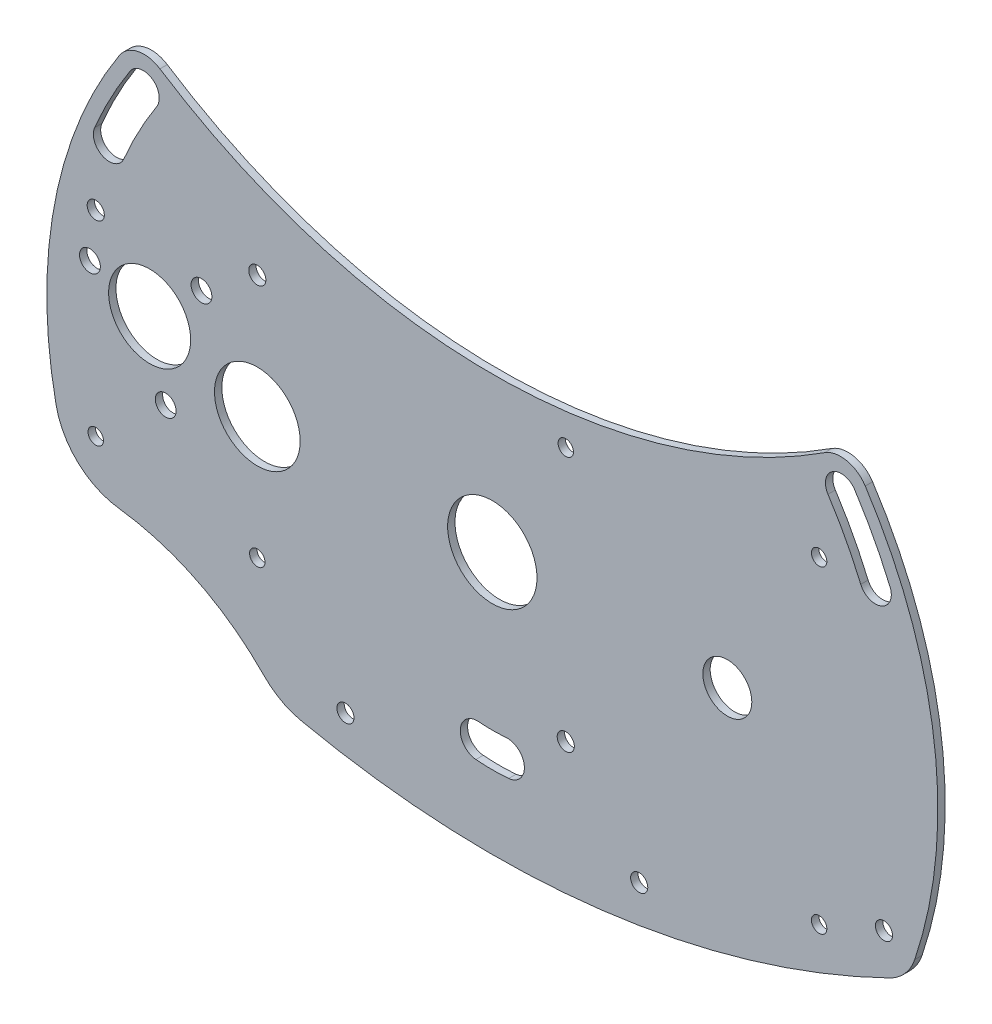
SolidWorks part; units mm, degrees
ref_plane "Face" through (0, 0, 0) normal (0, 0, 1) x (1, 0, 0)
ref_plane "Dessus" through (0, 0, 0) normal (0, 1, 0) x (1, 0, 0)
ref_plane "Droite" through (0, 0, 0) normal (1, 0, 0) x (0, 0, -1)
sketch "Esquisse1" plane through (0, 0, 0) normal (0, 0, 1) x (1, 0, 0)
  line L0 (0, 393.4751) -> (0, -393.4751) construction
  line L1 (393.4751, 0) -> (-393.4751, 0) construction
  line L2 (-150.6429, -313) -> (150.6429, -313) construction
  line L3 (-96, -313) -> (-222.1428, -274.4343) construction
  line L4 (-133.4329, -327.6979) -> (-118.8143, -279.8827) construction
  line L6 (31.9096, -50) -> (-31.9096, -50) construction
  line L9 (0, -313) -> (179.235, -344.604) construction
  arc A0 (135.7812, -209.913) -> (-135.7812, -209.913) centre (0, 0) cw
  arc A1 (-78.1861, -411.6448) -> (162.3743, -382.4674) centre (0, -50) ccw
  circle A2 centre (0, -313) radius 18.25
  circle A3 centre (96, -313) radius 10
  circle A4 centre (-96, -313) radius 17.5
  circle A5 centre (-139.99, -299.5509) radius 16.75
  circle A6 centre (-164.3758, -292.0954) radius 4.25
  circle A7 centre (-118.8143, -279.8827) radius 4.25
  circle A8 centre (-133.4329, -327.6979) radius 4.25
  arc A9 (-152.3433, -213.4233) -> (-178.1714, -350.134) centre (0, -313) ccw
  arc A10 (152.3433, -213.4233) -> (172.56, -370.8538) centre (0, -313) cw
  arc A11 (-135.7812, -209.913) -> (-152.3433, -213.4233) centre (-142.2987, -219.9888) ccw
  arc A12 (152.3433, -213.4233) -> (135.7812, -209.913) centre (142.2987, -219.9888) ccw
  arc A13 (162.3743, -382.4674) -> (172.56, -370.8538) centre (153.5973, -364.4962) ccw
  arc A14 (-93.3436, -403.2479) -> (-152.5404, -373.7792) centre (-165, -473) ccw
  arc A15 (-152.5404, -373.7792) -> (-178.1714, -350.134) centre (-148.8025, -344.013) cw
  arc A16 (-78.1861, -411.6448) -> (-93.3436, -403.2479) centre (-71.8467, -382.3222) cw
  point P28 (145.3191, -203.4265)
  point P43 (0, -50)
  dimension "D4" = 36.5
  dimension "D5" = 20
  dimension "D6" = 96
  dimension "D8" = 33.5
  dimension "D9" = 25.5
  dimension "D10" = 40
  dimension "D11" = 8.5
  dimension "D12" = 50
  dimension "D13" = 182
  dimension "D15" = 182
  dimension "D18" = 12
  dimension "D19" = 12
  dimension "D20" = 30
  dimension "D22" = 250
  dimension "D23" = 370
  dimension "D17" = 100
  dimension "D24" = 165
  dimension "D25" = 35
  dimension "D26" = 96
  dimension "D27" = 46
  dimension "D28" = 160
  dimension "D34" = 10
  dimension "D16" = 20
  dimension "D3" = 313
  dimension "D7" = 17
  dimension "D14" = 31.5
  dimension "D21" = 263
extrude "support" add sketch "Esquisse1" along normal blind 3
sketch "Esquisse2" plane through (0, 0, 3) normal (0, 0, 1) x (1, 0, 0)
  line L0 (154.5138, -313) -> (-170.0077, -313) construction
  line L1 (0, -205.5414) -> (0, -432.4915) construction
  line L2 (96, -313) -> (133.5, -248.0481) construction
  circle A0 centre (0, -313) radius 18.25 construction
  circle A1 centre (30, -261) radius 3.15
  circle A2 centre (30, -365) radius 3.5
  arc A3 (104.6624, -238.5019) -> (123.277, -382.8639) centre (96, -313) cw construction
  circle A4 centre (96, -313) radius 10 construction
  circle A5 centre (133.5, -248.0481) radius 3.15
  circle A6 centre (133.5, -377.9519) radius 3.15
  circle A7 centre (-96, -263) radius 3.5
  circle A8 centre (-96, -363) radius 3.15
  circle A9 centre (-162, -273) radius 3.5
  circle A10 centre (-162, -353) radius 3.15
  point P5 (0, -313)
  dimension "D1" = 6.3
  dimension "D2" = 30
  dimension "D3" = 104
  dimension "D4" = 75
  dimension "D6" = 100
  dimension "D7" = 96
  dimension "D8" = 66
  dimension "D9" = 80
  dimension "D10" = 7
  dimension "D5" = 60
extrude "fixation bloc trans" cut sketch "Esquisse2" against normal through all
sketch "Esquisse3" plane through (0, 0, 3) normal (0, 0, 1) x (1, 0, 0)
  line L0 (0, -282.0534) -> (0, -343.9466) construction
  line L1 (29.8832, -313) -> (-29.8832, -313) construction
  line L2 (-156.4858, -246.5757) -> (0, -313) construction
  line L3 (0, -313) -> (-142.574, -220.4114) construction
  line L4 (142.574, -220.4114) -> (0, -313) construction
  line L5 (-6.1009, -382.7336) -> (0, -313) construction
  line L6 (0, -313) -> (6.1009, -382.7336) construction
  circle A0 centre (0, -313) radius 18.25 construction
  arc A1 (-157.183, -248.2427) -> (-140.7316, -217.6343) centre (0, -313) cw construction
  arc A2 (-150.5025, -249.1155) -> (-137.1226, -223.9515) centre (0, -313) cw
  arc A3 (-162.4691, -244.036) -> (-148.0254, -216.8712) centre (0, -313) cw
  arc A4 (-162.4691, -244.036) -> (-150.5025, -249.1155) centre (-156.4858, -246.5757) ccw
  arc A5 (-148.0254, -216.8712) -> (-137.1226, -223.9515) centre (-142.574, -220.4114) cw
  arc A6 (162.4691, -244.036) -> (150.5025, -249.1155) centre (156.4858, -246.5757) cw
  arc A7 (162.4691, -244.036) -> (148.0254, -216.8712) centre (0, -313) ccw
  arc A8 (148.0254, -216.8712) -> (137.1226, -223.9515) centre (142.574, -220.4114) ccw
  arc A9 (150.5025, -249.1155) -> (137.1226, -223.9515) centre (0, -313) ccw
  arc A10 (-23.721, -378.8583) -> (23.721, -378.8583) centre (0, -313) ccw construction
  arc A11 (-5.4908, -375.7603) -> (5.4908, -375.7603) centre (0, -313) ccw
  arc A12 (-6.711, -389.707) -> (6.711, -389.707) centre (0, -313) ccw
  arc A13 (-5.4908, -375.7603) -> (-6.711, -389.707) centre (-6.1009, -382.7336) ccw
  arc A14 (5.4908, -375.7603) -> (6.711, -389.707) centre (6.1009, -382.7336) cw
  point P5 (0, -313)
  dimension "D1" = 170
  dimension "D2" = 6.5
  dimension "D5" = 70
  dimension "D6" = 7
  dimension "D3" = 10
  dimension "D4" = 114
  dimension "D7" = 10
extrude "lumière réglage" cut sketch "Esquisse3" against normal through all
sketch "Esquisse4" plane through (0, 0, 3) normal (0, 0, 1) x (1, 0, 0)
  line L0 (0, -313) -> (0, -458.7111) construction
  circle A3 centre (0, -313) radius 18.25 construction
  circle A9 centre (160, -366.899) radius 3.5
  circle A10 centre (60, -399.8928) radius 3.5
  circle A11 centre (-60, -399.8928) radius 3.5
  arc A12 (220.3415, -328.3427) -> (-200.8165, -342.7417) centre (0, -50) cw construction
  point P0 (0, -50)
  dimension "D1" = 7
  dimension "D2" = 60
  dimension "D9" = 355
  dimension "D6" = 120
  dimension "D7" = 100
extrude "fixation protection projection" cut sketch "Esquisse4" against normal through all
